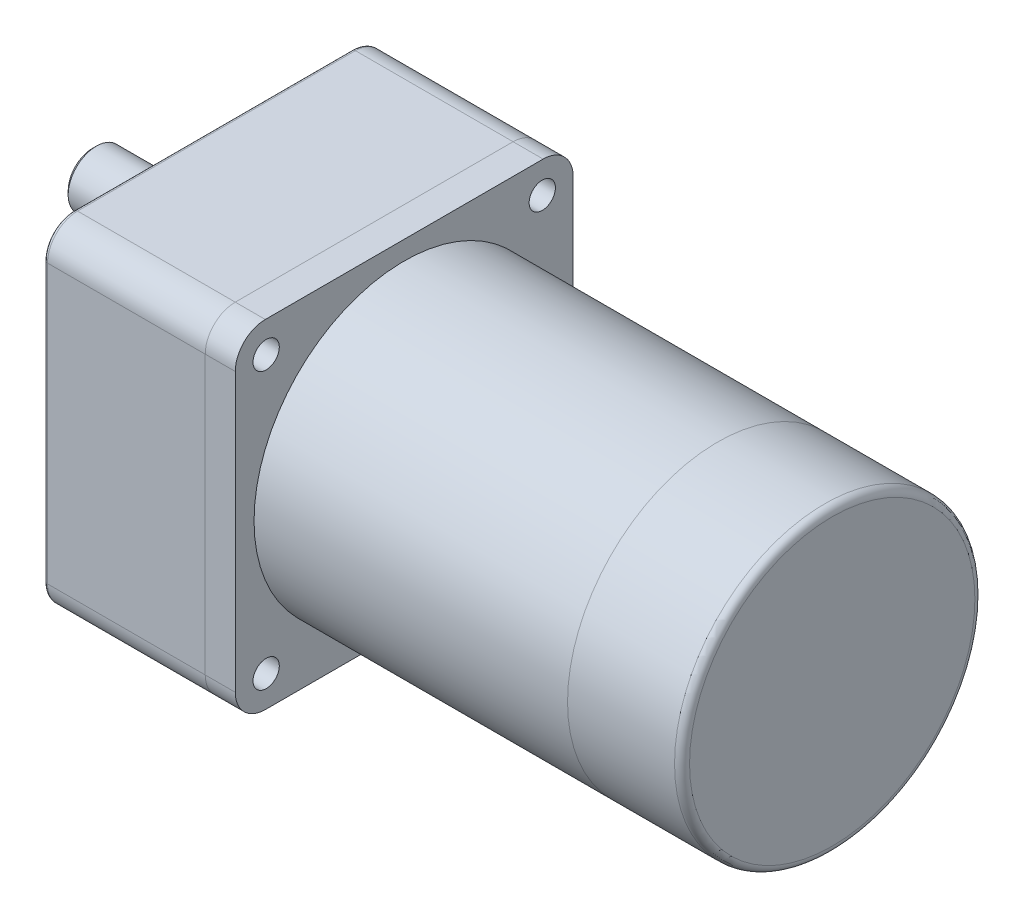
SolidWorks part; units mm, degrees
ref_plane "前视基准面" through (0, 0, 0) normal (0, 0, 1) x (1, 0, 0)
ref_plane "上视基准面" through (0, 0, 0) normal (0, 1, 0) x (1, 0, 0)
ref_plane "右视基准面" through (0, 0, 0) normal (1, 0, 0) x (0, 0, -1)
sketch "草图1" plane through (0, 0, 0) normal (1, 0, 0) x (0, 0, -1)
  line L1 (-37, -45) -> (37, -45)
  line L2 (-45, -37) -> (-45, 37)
  line L3 (-37, 45) -> (37, 45)
  line L4 (45, -37) -> (45, 37)
  line L5 (-45, -45) -> (45, 45) construction
  line L6 (-45, 45) -> (45, -45) construction
  arc A0 (-37, -45) -> (-45, -37) centre (-37, -37) cw
  arc A1 (37, -45) -> (45, -37) centre (37, -37) ccw
  arc A2 (37, 45) -> (45, 37) centre (37, 37) cw
  arc A3 (-45, 37) -> (-37, 45) centre (-37, 37) cw
  point P0 (0, 0)
  dimension "D1" = 8
extrude "凸台-拉伸1" add sketch "草图1" along normal blind 43
sketch "草图2" plane through (43, 0, 0) normal (1, 0, 0) x (0, 0, -1)
  line L0 (37, 45) -> (-37, 45) construction
  line L1 (-37, -45) -> (37, -45)
  line L2 (-45, -37) -> (-45, 37)
  line L3 (-37, 45) -> (37, 45)
  line L4 (45, -37) -> (45, 37)
  line L5 (-45, -45) -> (45, 45) construction
  line L6 (-45, 45) -> (45, -45) construction
  arc A0 (37, 45) -> (45, 37) centre (37, 37) cw
  arc A1 (37, -45) -> (45, -37) centre (37, -37) ccw
  arc A2 (-37, -45) -> (-45, -37) centre (-37, -37) cw
  arc A3 (-45, 37) -> (-37, 45) centre (-37, 37) cw
  point P0 (0, 0)
  dimension "D1" = 8
extrude "凸台-拉伸2" add sketch "草图2" along normal blind 8 separate body
fillet "圆角1" radius 1 8 edges at (0, -45, 0) (0, -42.6569, -42.6569) (0, 0, -45) (0, 42.6569, -42.6569) (0, 45, 0) (0, 42.6569, 42.6569) (0, 0, 45) (0, -42.6569, 42.6569)
sketch "草图3" plane through (51, 0, 0) normal (1, 0, 0) x (0, 0, -1)
  circle A0 centre (0, 0) radius 40
extrude "凸台-拉伸3" add sketch "草图3" along normal blind 83.5 separate body
sketch "草图4" plane through (134.5, 0, 0) normal (1, 0, 0) x (0, 0, -1)
  circle A0 centre (0, 0) radius 40
extrude "凸台-拉伸4" add sketch "草图4" along normal blind 30.5 separate body
fillet "圆角2" radius 2 1 edges at (165, 0, -40)
sketch "草图6" plane through (0, 0, 0) normal (-1, 0, 0) x (0, 0, 1)
  circle A0 centre (0, 18) radius 16
extrude "凸台-拉伸5" add sketch "草图6" along normal blind 3 separate body
fillet "圆角3" radius 0.5 1 edges at (-3, 18, 16)
sketch "草图7" plane through (-3, 0, 0) normal (-1, 0, 0) x (0, 0, 1)
  circle A0 centre (0, 18) radius 7.5
extrude "凸台-拉伸6" add sketch "草图7" along normal blind 29 separate body
ref_plane "基准面1" through (0, 0, -7.5) normal (0, 0, 1) x (1, 0, 0)
sketch "草图8" plane through (0, 0, -7.5) normal (0, 0, 1) x (1, 0, 0)
  line L1 (-32, 25.5) -> (-32, 10.5) construction
  line L2 (-9.5, 20.5) -> (-32, 20.5)
  line L3 (-32, 20.5) -> (-32, 15.5)
  line L4 (-32, 15.5) -> (-9.5, 15.5)
  arc A0 (-9.5, 15.5) -> (-9.5, 20.5) centre (-9.5, 18) ccw
extrude "切除-拉伸2" cut sketch "草图8" along normal blind 3
chamfer "倒角2" distance 1 angle 45 1 edges at (-32, 18, 7.5)
sketch "草图9" plane through (0, 0, 0) normal (-1, 0, 0) x (0, 0, 1)
  circle A0 centre (0, 0) radius 41.4
extrude "切除-拉伸3" cut sketch "草图9" against normal blind 0.5
fillet "圆角4" radius 0.5 1 edges at (0, 0, 41.4)
sketch "草图10" plane through (0, 0, 0) normal (-1, 0, 0) x (0, 0, 1)
  point P19 (-36.7696, 36.7696)
  point P20 (36.7696, 36.7696)
  point P21 (36.7696, -36.7696)
  point P22 (-36.7696, -36.7696)
hole_wizard "M6 螺纹孔1" positions "3D草图1" profile "草图11" tap size "M6" standard "GB"
sketch3d "3D草图1"
  point P0 (0, 36.7696, -36.7696)
  point P3 (0, 36.7696, 36.7696)
  point P6 (0, -36.7696, 36.7696)
  point P9 (0, -36.7696, -36.7696)
sketch "草图11" plane through (0, 36.7696, -36.7696) normal (0, 1, 0) x (0, 0, 1)
  line L0 (0, 0) -> (0, 18.5022)
  line L1 (0, 18.5022) -> (2.5, 17)
  line L2 (2.5, 17) -> (2.5, 0)
  line L5 (2.5, 0) -> (0, 0)
  line L10 (0, 18.5022) -> (-2.5, 17) construction
  line L11 (0, -6.35) -> (0, 107.95) construction
  dimension "螺纹孔钻头直径" = 5
  dimension "螺纹孔钻头深度" = 17
  dimension "导头角度" = 118
sketch "草图13" plane through (51, 0, 0) normal (1, 0, 0) x (0, 0, -1)
  circle A0 centre (-36.7696, 36.7696) radius 3.5
  circle A1 centre (36.7696, 36.7696) radius 3.5
  circle A2 centre (36.7696, -36.7696) radius 3.5
  circle A3 centre (-36.7696, -36.7696) radius 3.5
extrude "切除-拉伸4" cut sketch "草图13" against normal blind 44
fillet "圆角5" radius 1 4 edges at (0, -36.7696, -34.2696) (0, -36.7696, 39.2696) (0, 36.7696, 39.2696) (0, 36.7696, -34.2696)
